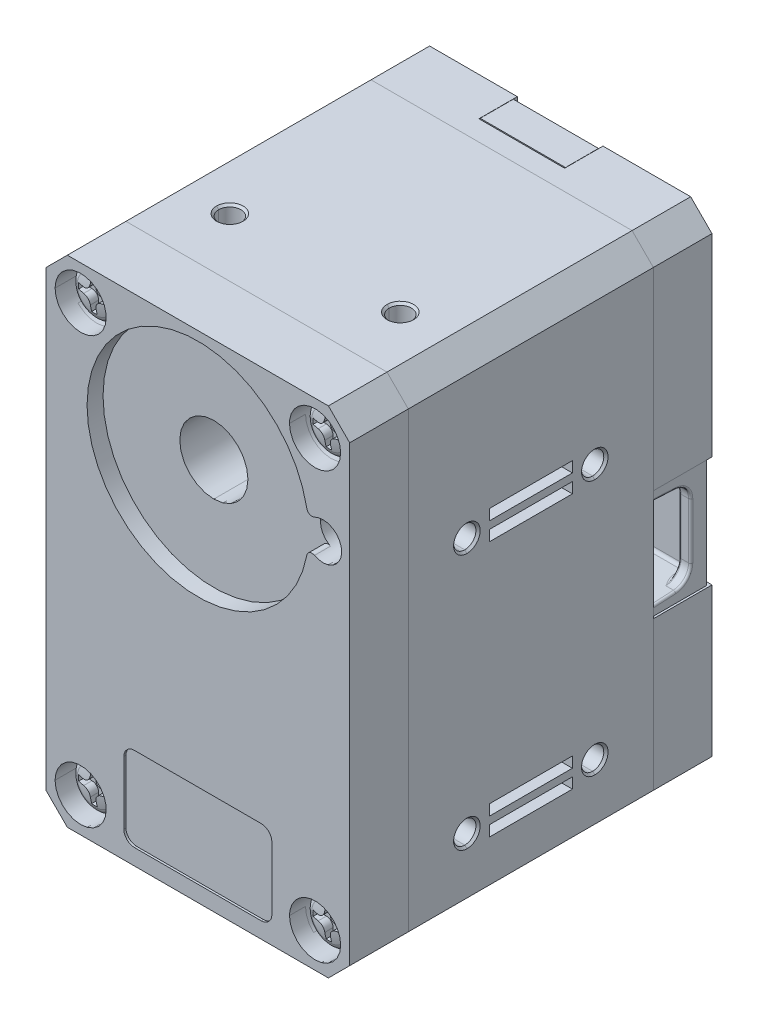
SolidWorks part; units mm, degrees
ref_plane "Front Plane" through (0, 0, 0) normal (0, 0, 1) x (1, 0, 0)
ref_plane "Top Plane" through (0, 0, 0) normal (0, 1, 0) x (1, 0, 0)
ref_plane "Right Plane" through (0, 0, 0) normal (1, 0, 0) x (0, 0, -1)
imported_body "XC-430_idle.stp<1>"
delete or keep bodies "Body-Delete/Keep 1" type delete bodies bodies 101 102 104 106 108 110 111 103 105 107 109 112 115 117 119 121 123 114 116 118 120 122 113
delete or keep bodies "Body-Delete/Keep 2" [suppressed] type keep bodies bodies 101 102 104 106 108 110 111 113 114 116 118 122 120 105 107 109 115 117 112 119 121 123 103
